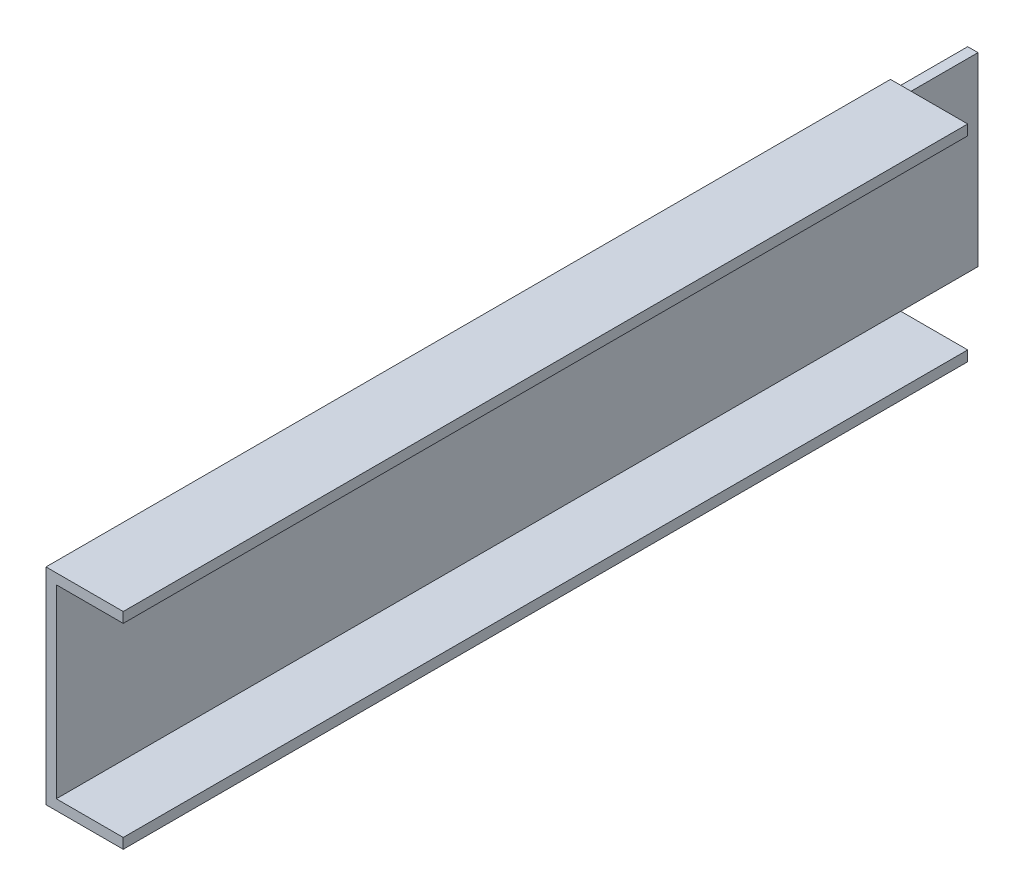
SolidWorks part; units mm, degrees
ref_plane "Front Plane" through (0, 0, 0) normal (0, 0, 1) x (1, 0, 0)
ref_plane "Top Plane" through (0, 0, 0) normal (0, 1, 0) x (1, 0, 0)
ref_plane "Right Plane" through (0, 0, 0) normal (1, 0, 0) x (0, 0, -1)
sketch "Sketch1" plane through (0, 0, 0) normal (0, 0, 1) x (1, 0, 0)
  line L0 (75, 0) -> (0, 0)
  line L1 (0, 0) -> (0, 200)
  line L2 (0, 200) -> (75, 200)
  line L3 (75, 200) -> (75, 190)
  line L4 (75, 190) -> (10, 190)
  line L5 (10, 190) -> (10, 10)
  line L6 (10, 10) -> (75, 10)
  line L7 (75, 10) -> (75, 0)
  dimension "D1" = 200
  dimension "D2" = 75
  dimension "D3" = 10
  dimension "D4" = 10
extrude "Boss-Extrude1" add sketch "Sketch1" along normal mid plane 895
sketch "Sketch2" plane through (75, 0, 0) normal (1, 0, 0) x (0, 0, -1)
  line L0 (-447.5, 190) -> (447.5, 190) construction
  line L1 (447.5, 200) -> (372.5, 200)
  line L2 (447.5, 200) -> (447.5, 190)
  line L3 (447.5, 190) -> (372.5, 190)
  line L4 (372.5, 200) -> (372.5, 190)
  line L5 (-447.5, 0) -> (447.5, 0) construction
  line L6 (447.5, 10) -> (372.5, 10)
  line L7 (447.5, 10) -> (447.5, 0)
  line L8 (447.5, 0) -> (372.5, 0)
  line L9 (372.5, 10) -> (372.5, 0)
  line L10 (372.5, 190) -> (372.5, 200) construction
  line L11 (372.5, 0) -> (372.5, 10) construction
extrude "Cut-Extrude1" cut sketch "Sketch2" against normal up to surface (75 mm away)
